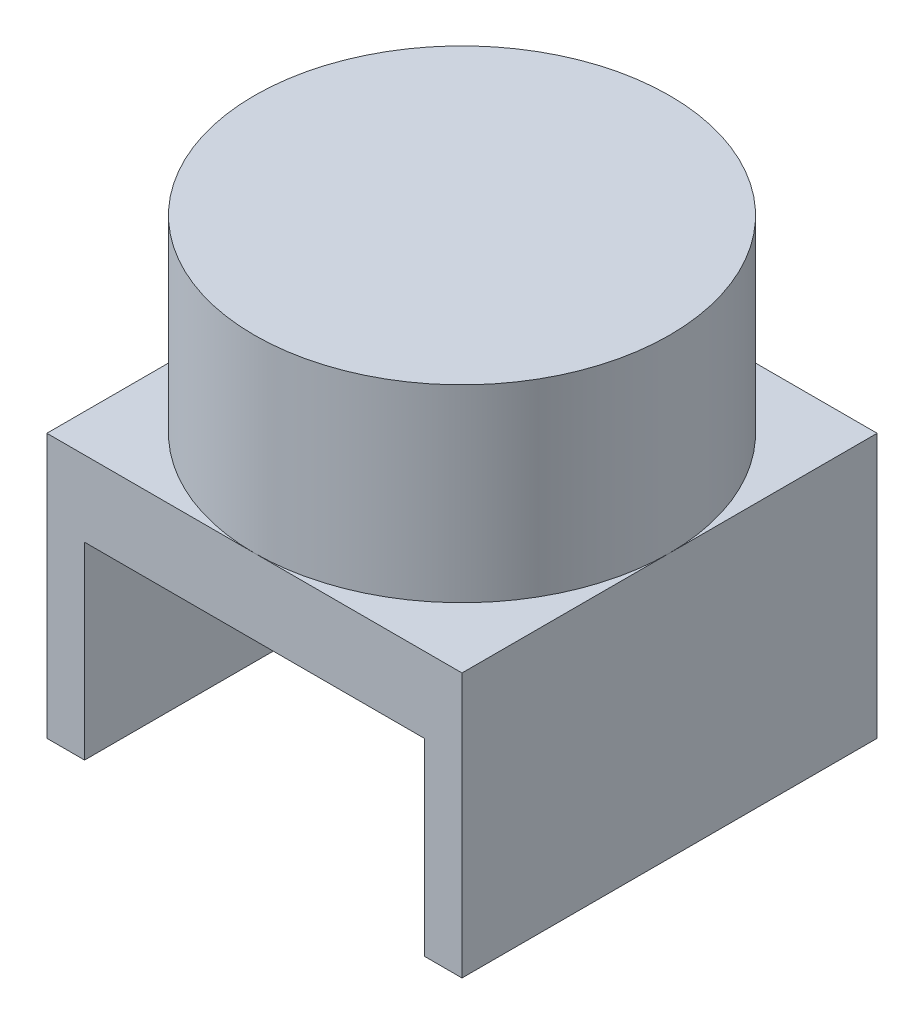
SolidWorks part; units mm, degrees
ref_plane "Front View" through (0, 0, 0) normal (0, 0, 1) x (1, 0, 0)
ref_plane "Upper View" through (0, 0, 0) normal (0, 1, 0) x (1, 0, 0)
ref_plane "Right View" through (0, 0, 0) normal (1, 0, 0) x (0, 0, -1)
sketch "Sketch1" plane through (0, 0, 0) normal (0, 1, 0) x (1, 0, 0)
  circle A0 centre (0, 0) radius 55
extrude "Boss-Extrude1" add sketch "Sketch1" along normal blind 50
sketch "Sketch2" plane through (0, 0, 0) normal (0, -1, 0) x (-1, 0, 0)
  line L0 (55, -55) -> (-55, -55)
  line L2 (-55, -55) -> (-55, 55)
  line L3 (-55, 55) -> (55, 55)
  line L4 (55, 55) -> (55, -55)
extrude "Boss-Extrude2" add sketch "Sketch2" along normal blind 20
sketch "Sketch3" plane through (0, -20, 0) normal (0, -1, 0) x (-1, 0, 0)
  line L0 (55, -55) -> (45, -55)
  line L1 (45, -55) -> (45, 55)
  line L2 (55, 55) -> (-55, 55) construction
  line L3 (45, 55) -> (55, 55)
  line L4 (55, 55) -> (55, -55)
  line L5 (-55, -55) -> (-45, -55)
  line L6 (-45, -55) -> (-45, 55)
  line L7 (-45, 55) -> (-55, 55)
  line L8 (-55, 55) -> (-55, -55)
extrude "Boss-Extrude3" add sketch "Sketch3" along normal blind 50
